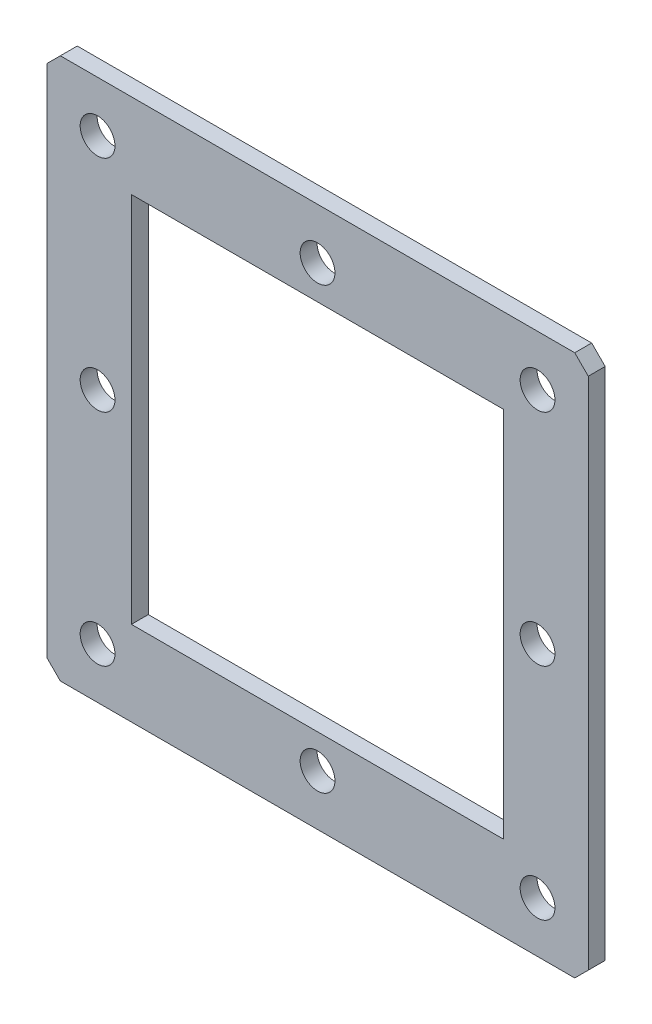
SolidWorks part; units mm, degrees
ref_plane "Front Plane" through (0, 0, 0) normal (0, 0, 1) x (1, 0, 0)
ref_plane "Top Plane" through (0, 0, 0) normal (0, 1, 0) x (1, 0, 0)
ref_plane "Right Plane" through (0, 0, 0) normal (1, 0, 0) x (0, 0, -1)
sketch "Sketch1" plane through (0, 0, 0) normal (0, 0, 1) x (1, 0, 0)
  line L0 (-50.4258, 48.8836) -> (-47.8858, 51.4236)
  line L1 (-47.8858, -50.1764) -> (48.6342, -50.1764)
  line L2 (-50.4258, -47.6364) -> (-50.4258, 48.8836)
  line L3 (-47.8858, 51.4236) -> (48.6342, 51.4236)
  line L4 (51.1742, -47.6364) -> (51.1742, 48.8836)
  line L5 (-50.4258, -50.1764) -> (51.1742, 51.4236) construction
  line L6 (-50.4258, 51.4236) -> (51.1742, -50.1764) construction
  line L7 (48.6342, 51.4236) -> (51.1742, 48.8836)
  line L8 (48.6342, -50.1764) -> (51.1742, -47.6364)
  line L9 (-50.4258, -47.6364) -> (-47.8858, -50.1764)
  line L10 (-40.9008, 41.8986) -> (0.3742, 41.8986)
  line L11 (41.6492, -40.6514) -> (-40.9008, -40.6514) construction
  line L12 (41.6492, -40.6514) -> (41.6492, 41.8986) construction
  line L13 (41.6492, 41.8986) -> (-40.9008, 41.8986) construction
  line L14 (-40.9008, -40.6514) -> (-40.9008, 41.8986) construction
  line L15 (41.6492, -40.6514) -> (-40.9008, 41.8986) construction
  line L16 (41.6492, 41.8986) -> (-40.9008, -40.6514) construction
  line L17 (41.6492, -40.6514) -> (0.3742, -40.6514)
  line L18 (-34.5508, -34.3014) -> (35.2992, -34.3014)
  line L19 (-34.5508, -34.3014) -> (-34.5508, 35.5486)
  line L20 (-34.5508, 35.5486) -> (35.2992, 35.5486)
  line L21 (35.2992, -34.3014) -> (35.2992, 35.5486)
  line L22 (-34.5508, -34.3014) -> (35.2992, 35.5486) construction
  line L23 (-34.5508, 35.5486) -> (35.2992, -34.3014) construction
  circle A0 centre (-40.9008, 41.8986) radius 3.2639
  circle A1 centre (0.3742, 41.8986) radius 3.2639
  circle A2 centre (41.6492, 41.8986) radius 3.2639
  circle A3 centre (41.6492, 0.6236) radius 3.2639
  circle A4 centre (41.6492, -40.6514) radius 3.2639
  circle A5 centre (0.3742, -40.6514) radius 3.2639
  circle A6 centre (-40.9008, -40.6514) radius 3.2639
  circle A7 centre (-40.9008, 0.6236) radius 3.2639
  circle A8 centre (-20.2633, 41.8986) radius 4.7625 construction
  circle A9 centre (21.0117, -40.6514) radius 4.7625 construction
  point P0 (0.3742, 0.6236)
  point P13 (0.3742, 0.6236)
  point P34 (0.3742, 0.6236)
  dimension "D13" = 6.5278
  dimension "D14" = 9.525
  dimension "D1" = 101.6
  dimension "D2" = 101.6
  dimension "D3" = 2.54
  dimension "D4" = 2.54
  dimension "D5" = 2.54
  dimension "D6" = 2.54
  dimension "D7" = 2.54
  dimension "D8" = 2.54
  dimension "D9" = 2.54
  dimension "D10" = 2.54
  dimension "D11" = 82.55
  dimension "D12" = 82.55
  dimension "D15" = 69.85
  dimension "D16" = 69.85
extrude "Boss-Extrude1" add sketch "Sketch1" along normal blind 3.175
